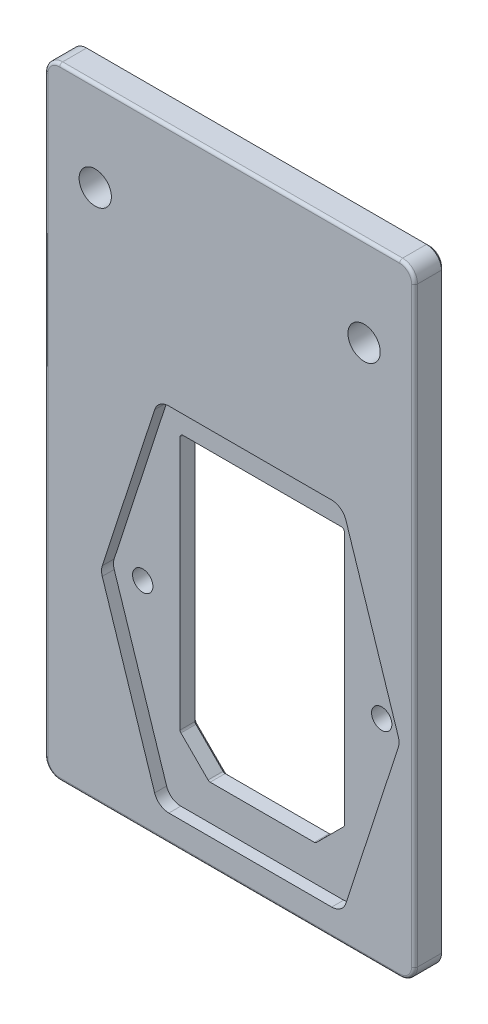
SolidWorks part; units mm, degrees
ref_plane "Płaszczyzna przednia" through (0, 0, 0) normal (0, 0, 1) x (1, 0, 0)
ref_plane "Płaszczyzna górna" through (0, 0, 0) normal (0, 1, 0) x (1, 0, 0)
ref_plane "Płaszczyzna prawa" through (0, 0, 0) normal (1, 0, 0) x (0, 0, -1)
sketch "Szkic1" plane through (0, 0, 0) normal (0, 0, 1) x (1, 0, 0)
  line L0 (-105.1361, 102.712) -> (-43.2389, 102.712)
  line L1 (-105.1361, 102.712) -> (-105.1361, -1.288)
  line L2 (-105.1361, -1.288) -> (-43.2389, -1.288)
  line L3 (-43.2389, 102.712) -> (-43.2389, -1.288)
  line L4 (-84.3669, 3.712) -> (-57.1109, 3.712) construction
  line L5 (-95.0383, 32.0942) -> (-86.2691, 5.0942) construction
  line L6 (-86.2691, 60.3298) -> (-95.0383, 33.3298) construction
  line L7 (-57.1109, 61.712) -> (-84.3669, 61.712) construction
  line L8 (-46.4396, 33.3298) -> (-55.2087, 60.3298) construction
  line L9 (-55.2087, 5.0942) -> (-46.4396, 32.0942) construction
  line L10 (-56.9889, 57.1438) -> (-84.4889, 57.1438)
  line L11 (-84.4889, 57.1438) -> (-84.4889, 13.9751)
  line L12 (-84.4889, 13.9751) -> (-79.6575, 9.1438)
  line L13 (-79.6575, 9.1438) -> (-61.8203, 9.1438)
  line L14 (-61.8203, 9.1438) -> (-56.9889, 13.9751)
  line L15 (-56.9889, 13.9751) -> (-56.9889, 57.1438)
  line L16 (-96.6875, 87.712) -> (-51.6875, 87.712) construction
  line L17 (-74.1875, 87.712) -> (-74.1875, 102.712) construction
  circle A0 centre (-96.6875, 87.712) radius 2.7
  circle A1 centre (-50.7389, 32.7119) radius 2.25 construction
  circle A2 centre (-90.7389, 32.7119) radius 2.25 construction
  circle A3 centre (-51.6875, 87.712) radius 2.7
  arc A4 (-86.2691, 5.0942) -> (-84.3669, 3.712) centre (-84.3669, 5.712) ccw construction
  arc A5 (-95.0383, 33.3298) -> (-95.0383, 32.0942) centre (-93.1361, 32.712) ccw construction
  arc A6 (-84.3669, 61.712) -> (-86.2691, 60.3298) centre (-84.3669, 59.712) ccw construction
  arc A7 (-55.2087, 60.3298) -> (-57.1109, 61.712) centre (-57.1109, 59.712) ccw construction
  arc A8 (-46.4396, 32.0942) -> (-46.4396, 33.3298) centre (-48.3418, 32.712) ccw construction
  arc A9 (-57.1109, 3.712) -> (-55.2087, 5.0942) centre (-57.1109, 5.712) ccw construction
  circle A10 centre (-90.7389, 32.7119) radius 1.7
  circle A11 centre (-50.7389, 32.7119) radius 1.7
  dimension "D1" = 40
extrude "Dodanie-wyciągnięcie1" add sketch "Szkic1" along normal blind 5
sketch "Szkic2" plane through (0, 0, 5) normal (0, 0, 1) x (1, 0, 0)
  line L0 (-95.0383, 32.0942) -> (-86.2691, 5.0942) construction
  line L1 (-84.3669, 3.712) -> (-57.1109, 3.712) construction
  line L2 (-55.2087, 5.0942) -> (-46.4396, 32.0942) construction
  line L3 (-46.4396, 33.3298) -> (-55.2087, 60.3298) construction
  line L4 (-57.1109, 61.712) -> (-84.3669, 61.712) construction
  line L5 (-86.2691, 60.3298) -> (-95.0383, 33.3298) construction
  line L6 (-95.0383, 32.0942) -> (-86.2691, 5.0942) construction
  line L7 (-84.3669, 3.712) -> (-57.1109, 3.712) construction
  line L8 (-55.2087, 5.0942) -> (-46.4396, 32.0942) construction
  line L9 (-46.4396, 33.3298) -> (-55.2087, 60.3298) construction
  line L10 (-57.1109, 61.712) -> (-84.3669, 61.712) construction
  line L11 (-86.2691, 60.3298) -> (-95.0383, 33.3298) construction
  line L12 (-95.5138, 31.9397) -> (-86.7446, 4.9397)
  line L13 (-84.3669, 3.212) -> (-57.1109, 3.212)
  line L14 (-54.7332, 4.9397) -> (-45.964, 31.9397)
  line L15 (-45.964, 33.4842) -> (-54.7332, 60.4842)
  line L16 (-57.1109, 62.212) -> (-84.3669, 62.212)
  line L17 (-86.7446, 60.4842) -> (-95.5138, 33.4842)
  arc A0 (-57.1109, 3.712) -> (-55.2087, 5.0942) centre (-57.1109, 5.712) ccw construction
  arc A1 (-46.4396, 32.0942) -> (-46.4396, 33.3298) centre (-48.3418, 32.712) ccw construction
  arc A2 (-95.0383, 33.3298) -> (-95.0383, 32.0942) centre (-93.1361, 32.712) ccw construction
  arc A3 (-86.2691, 5.0942) -> (-84.3669, 3.712) centre (-84.3669, 5.712) ccw construction
  arc A4 (-55.2087, 60.3298) -> (-57.1109, 61.712) centre (-57.1109, 59.712) ccw construction
  arc A5 (-84.3669, 61.712) -> (-86.2691, 60.3298) centre (-84.3669, 59.712) ccw construction
  arc A6 (-57.1109, 3.712) -> (-55.2087, 5.0942) centre (-57.1109, 5.712) ccw construction
  arc A7 (-46.4396, 32.0942) -> (-46.4396, 33.3298) centre (-48.3418, 32.712) ccw construction
  arc A8 (-95.0383, 33.3298) -> (-95.0383, 32.0942) centre (-93.1361, 32.712) ccw construction
  arc A9 (-86.2691, 5.0942) -> (-84.3669, 3.712) centre (-84.3669, 5.712) ccw construction
  arc A10 (-55.2087, 60.3298) -> (-57.1109, 61.712) centre (-57.1109, 59.712) ccw construction
  arc A11 (-84.3669, 61.712) -> (-86.2691, 60.3298) centre (-84.3669, 59.712) ccw construction
  arc A12 (-86.7446, 4.9397) -> (-84.3669, 3.212) centre (-84.3669, 5.712) ccw
  arc A13 (-57.1109, 3.212) -> (-54.7332, 4.9397) centre (-57.1109, 5.712) ccw
  arc A14 (-45.964, 31.9397) -> (-45.964, 33.4842) centre (-48.3418, 32.712) ccw
  arc A15 (-54.7332, 60.4842) -> (-57.1109, 62.212) centre (-57.1109, 59.712) ccw
  arc A16 (-84.3669, 62.212) -> (-86.7446, 60.4842) centre (-84.3669, 59.712) ccw
  arc A17 (-95.5138, 33.4842) -> (-95.5138, 31.9397) centre (-93.1361, 32.712) ccw
  dimension "D1" = 0.5
extrude "Wytnij-wyciągnięcie2" cut sketch "Szkic2" against normal blind 2
fillet "Zaokrąglenie1" radius 2.5 4 edges at (-43.2389, 102.712, 2.5) (-105.1361, 102.712, 2.5) (-105.1361, -1.288, 2.5) (-43.2389, -1.288, 2.5)
fillet "Zaokrąglenie2" radius 0.5 6 edges at (-56.9889, 13.9751, 1.5) (-61.8203, 9.1438, 1.5) (-79.6575, 9.1438, 1.5) (-84.4889, 13.9751, 1.5) (-84.4889, 57.1438, 1.5) (-56.9889, 57.1438, 1.5)
fillet "Zaokrąglenie3" radius 0.5 8 edges at (-43.9712, 101.9797, 5) (-43.2389, 50.712, 5) (-43.9712, -0.5558, 5) (-74.1875, -1.288, 5) (-104.4038, -0.5558, 5) (-105.1361, 50.712, 5) (-104.4038, 101.9797, 5) (-74.1875, 102.712, 5)
chamfer "Sfazowanie1" distance 0.5 angle 45 24 edges at (-49.0389, 32.7119, 0) (-89.0389, 32.7119, 0) (-48.9875, 87.712, 0) (-93.9875, 87.712, 0) (-61.8361, 9.1818, 0) (-70.7389, 9.1438, 0) (-79.6418, 9.1818, 0) (-82.0732, 11.5594, 0) (-84.4509, 13.9909, 0) (-84.4889, 35.413, 0) (-84.3425, 56.9973, 0) (-70.7389, 57.1438, 0) (-57.1354, 56.9973, 0) (-56.9889, 35.413, 0) (-57.027, 13.9909, 0) (-59.4046, 11.5594, 0) (-104.4038, 101.9797, 0) (-105.1361, 50.712, 0) (-104.4038, -0.5558, 0) (-74.1875, -1.288, 0) (-43.9712, -0.5558, 0) (-43.2389, 50.712, 0) (-43.9712, 101.9797, 0) (-74.1875, 102.712, 0)
